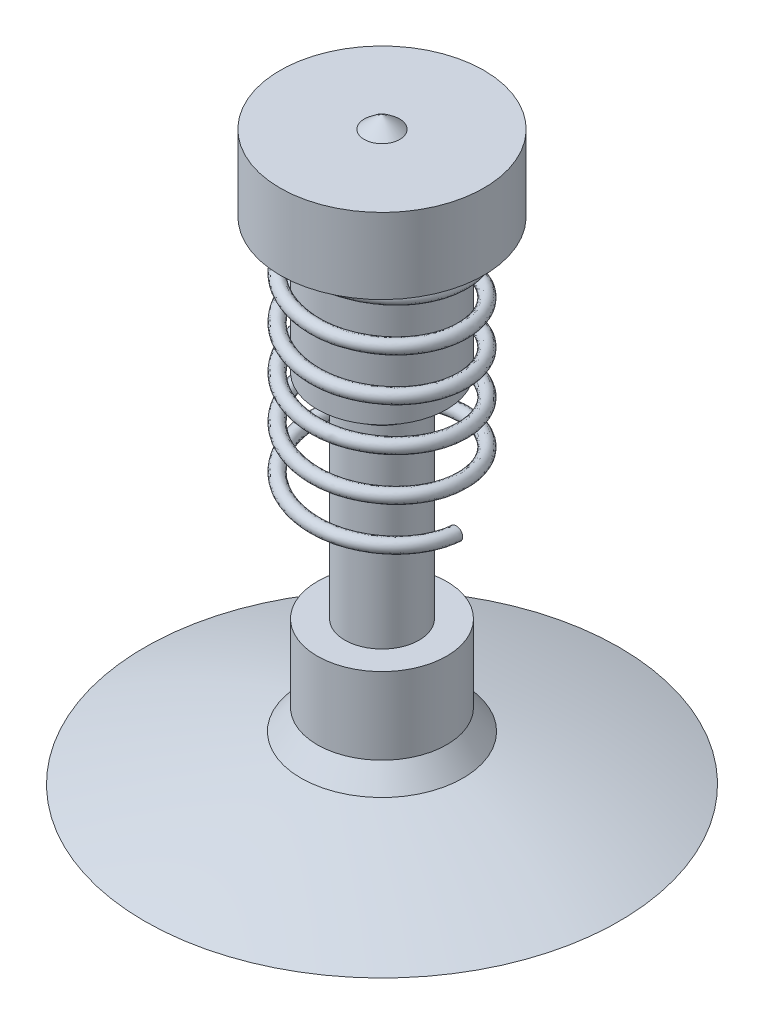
SolidWorks part; units mm, degrees
ref_plane "正面" through (0, 0, 0) normal (0, 0, 1) x (1, 0, 0)
ref_plane "平面" through (0, 0, 0) normal (0, 1, 0) x (1, 0, 0)
ref_plane "右側面" through (0, 0, 0) normal (1, 0, 0) x (0, 0, -1)
sketch "ｽｹｯﾁ1" plane through (0, 0, 0) normal (0, 0, 1) x (1, 0, 0)
  line L0 (0, 2.69) -> (0, 0)
  line L1 (0, 0) -> (1.1, 0)
  line L2 (0.3757, 0.2125) -> (0.3, 0.3086)
  line L3 (0.3, 0.3086) -> (0.3, 0.6645)
  line L4 (0.3, 0.6645) -> (0.172, 0.6645)
  line L5 (0.172, 0.6645) -> (0.172, 1.5622)
  line L6 (0.172, 1.5622) -> (0.3, 1.655)
  line L7 (0.3, 1.655) -> (0.3, 2.28)
  line L8 (0.3, 2.28) -> (0.4726, 2.28)
  line L9 (0.4726, 2.28) -> (0.4726, 2.63)
  line L10 (0.4726, 2.63) -> (0.0824, 2.63)
  arc A0 (1.1, 0) -> (0.3757, 0.2125) centre (-0.7403, -4.9328) ccw
  arc A1 (0.0824, 2.63) -> (0, 2.69) centre (-0.3534, 2.1184) ccw
  dimension "D1" = 2.69
  dimension "D2" = 1.1
  dimension "D3" = 0.35
  dimension "D4" = 0.625
  dimension "D5" = 0.172
  dimension "D6" = 0.3
  dimension "D7" = 0.3
  dimension "D8" = 0.06
revolve "回転1" add sketch "ｽｹｯﾁ1" angle 360 about L0
sketch "ｽｹｯﾁ2" plane through (0, 2.28, 0) normal (0, -1, 0) x (1, 0, 0)
  circle A0 centre (0, 0) radius 0.344
  dimension "D1" = 0.688
curve "ﾍﾘｶﾙ ｶｰﾌﾞ/ｽﾊﾟｲﾗﾙ ｶｰﾌﾞ1"
sketch "ｽｹｯﾁ3" plane through (0, 0, 0) normal (0, 0, 1) x (1, 0, 0)
  circle A0 centre (0.344, 2.18) radius 0.03
  dimension "D1" = 0.06
sweep "ｽｲｰﾌﾟ1" add profiles "ｽｹｯﾁ3" path "ﾍﾘｶﾙ ｶｰﾌﾞ/ｽﾊﾟｲﾗﾙ ｶｰﾌﾞ1"
